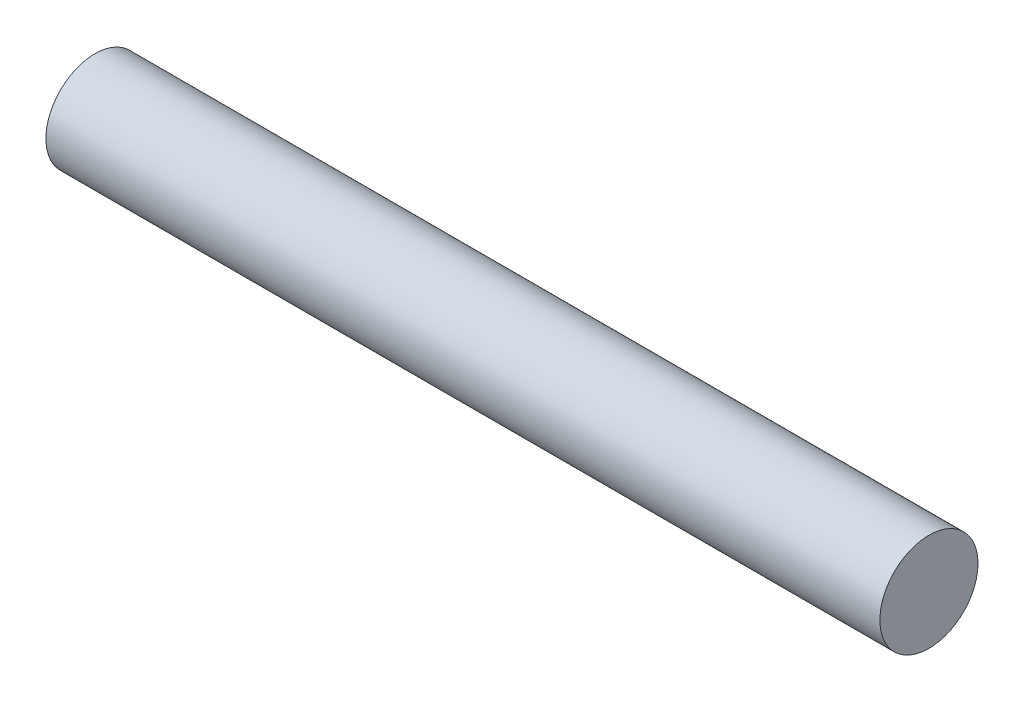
SolidWorks part; units mm, degrees
ref_plane "Front Plane" through (0, 0, 0) normal (0, 0, 1) x (1, 0, 0)
ref_plane "Top Plane" through (0, 0, 0) normal (0, 1, 0) x (1, 0, 0)
ref_plane "Right Plane" through (0, 0, 0) normal (1, 0, 0) x (0, 0, -1)
sketch "Sketch1" plane through (0, 0, 0) normal (1, 0, 0) x (0, 0, -1)
  circle A0 centre (0, 0) radius 12.7
  dimension "D1" = 25.4
extrude "Boss-Extrude1" add sketch "Sketch1" along normal blind 215.9
